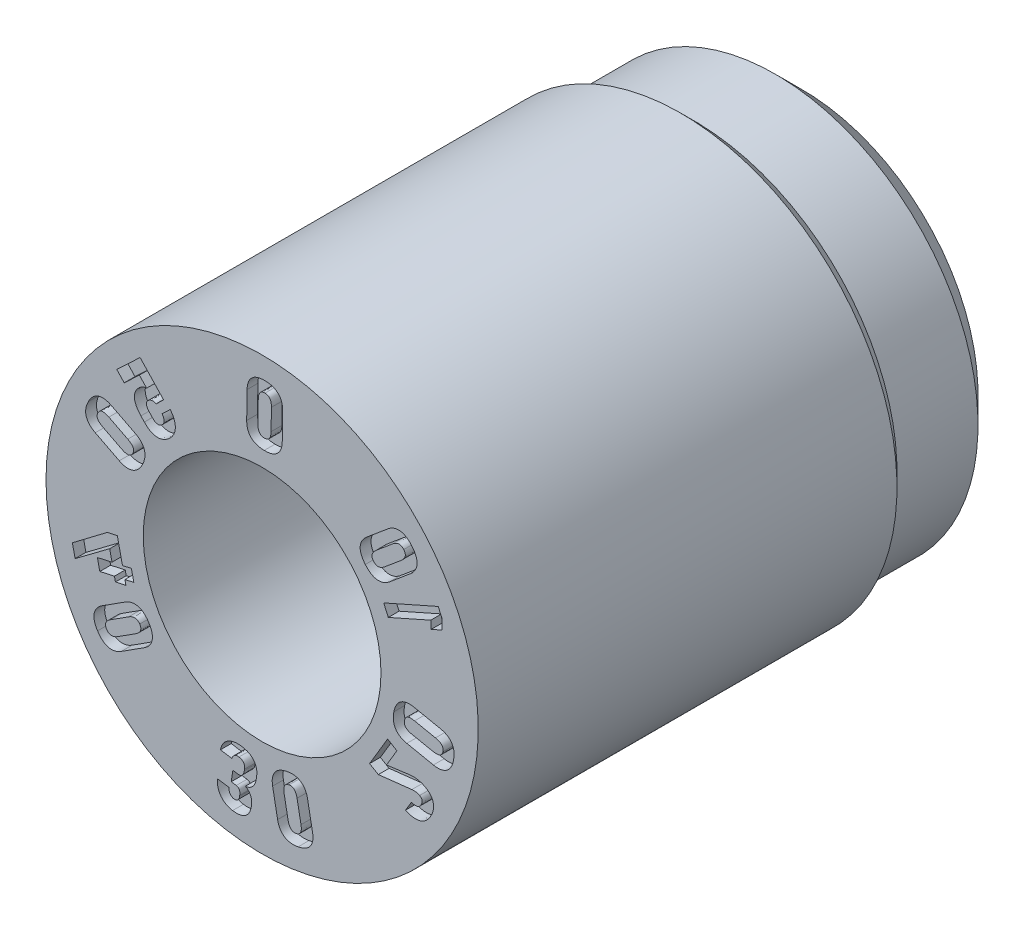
SolidWorks part; units mm, degrees
ref_plane "Front Plane" through (0, 0, 0) normal (0, 0, 1) x (1, 0, 0)
ref_plane "Top Plane" through (0, 0, 0) normal (0, 1, 0) x (1, 0, 0)
ref_plane "Right Plane" through (0, 0, 0) normal (1, 0, 0) x (0, 0, -1)
sketch "Sketch2" plane through (0, 0, 0) normal (0, 1, 0) x (1, 0, 0)
  line L0 (0, 4.8491) -> (0, -49995.1509) construction
  line L10 (3.2496, 10) -> (1.15, 10)
  line L11 (3.75, 9.4996) -> (3.2496, 10)
  line L12 (3.75, 8) -> (3.75, 9.4996)
  line L13 (4, 7.75) -> (3.75, 8)
  line L14 (4, 0) -> (4, 7.75)
  line L15 (2.2, 0) -> (4, 0)
  line L16 (2.2, 0) -> (2.2, 7.468)
  line L17 (1.15, 7.468) -> (2.2, 7.468)
  line L18 (1.15, 7.468) -> (1.15, 10)
  dimension "D1" = 8
  dimension "D2" = 4.4
  dimension "D3" = 2.532
  dimension "D4" = 2.3
  dimension "D5" = 7.5
  dimension "D6" = 10
  dimension "D7" = 45
  dimension "D8" = 45
  dimension "D9" = 2
  dimension "D10" = 0.5004
revolve "Revolve1" add sketch "Sketch2" angle 360 about L0
sketch "Sketch7" plane through (0, 0, 0) normal (0, 0, 1) x (1, 0, 0)
  line L0 (0.3725, 2.7961) -> (0.38, 3.2963)
  line L1 (-0.2782, 3.3062) -> (-0.2857, 2.806)
  line L2 (-0.0776, 2.8562) -> (-0.0715, 3.2502)
  line L3 (0.1719, 3.2466) -> (0.1659, 2.8525)
  line L4 (2.3612, 1.5443) -> (2.7454, 1.8659)
  line L5 (2.3221, 2.3715) -> (1.938, 2.0499)
  line L6 (2.1121, 1.9248) -> (2.4147, 2.1781)
  line L7 (2.5713, 1.991) -> (2.2686, 1.7376)
  line L8 (2.2508, 1.1502) -> (2.3351, 0.96)
  line L9 (2.3351, 0.96) -> (3.1205, 1.3086)
  line L10 (3.1205, 1.3086) -> (3.1287, 1.1654)
  line L11 (3.1287, 1.1654) -> (3.3306, 1.2549)
  line L12 (3.3306, 1.2549) -> (3.3315, 1.4356)
  line L13 (3.3315, 1.4356) -> (3.2595, 1.5981)
  line L14 (3.2595, 1.5981) -> (2.2508, 1.1502)
  line L15 (2.6785, -0.8868) -> (3.1694, -0.9878)
  line L16 (3.3021, -0.3418) -> (2.8112, -0.2408)
  line L17 (2.8212, -0.4551) -> (3.2082, -0.5344)
  line L18 (3.159, -0.7736) -> (2.7721, -0.6942)
  line L19 (2.1503, -1.6515) -> (2.7714, -1.5807)
  line L20 (2.9143, -1.6033) -> (2.9158, -1.604)
  line L21 (2.7652, -1.7854) -> (2.7644, -1.7851)
  line L22 (2.7644, -1.7851) -> (2.6555, -1.9681)
  line L23 (2.6555, -1.9681) -> (2.6562, -1.9685)
  line L24 (3.0303, -1.4233) -> (3.0296, -1.4229)
  line L25 (2.7357, -1.3635) -> (2.3021, -1.4215)
  line L26 (2.3021, -1.4215) -> (2.4949, -1.0975)
  line L27 (2.4949, -1.0975) -> (2.3229, -0.995)
  line L28 (2.3229, -0.995) -> (1.9893, -1.5555)
  line L29 (1.9893, -1.5555) -> (2.1503, -1.6515)
  line L30 (0.1945, -2.814) -> (0.2866, -3.3051)
  line L31 (0.9327, -3.1837) -> (0.8406, -2.6926)
  line L32 (0.6468, -2.783) -> (0.7195, -3.17)
  line L33 (0.4802, -3.2148) -> (0.4075, -2.8278)
  line L34 (-0.7721, -2.7159) -> (-0.56, -2.748)
  line L35 (-0.3261, -2.8028) -> (-0.3298, -2.8283)
  line L36 (-0.4492, -2.943) -> (-0.5414, -2.929)
  line L37 (-0.5414, -2.929) -> (-0.5714, -3.1268)
  line L38 (-0.5714, -3.1268) -> (-0.4793, -3.1408)
  line L39 (-0.4147, -3.2657) -> (-0.4175, -3.2843)
  line L40 (-0.617, -3.238) -> (-0.8284, -3.2058)
  line L41 (-0.2001, -3.3388) -> (-0.1952, -3.3058)
  line L42 (-0.1071, -2.846) -> (-0.102, -2.8131)
  line L43 (-2.5384, -1.2307) -> (-2.9598, -1.5002)
  line L44 (-2.605, -2.0546) -> (-2.1836, -1.785)
  line L45 (-2.3399, -1.639) -> (-2.6718, -1.8513)
  line L46 (-2.8032, -1.6462) -> (-2.4713, -1.4338)
  line L47 (-2.8657, -0.2778) -> (-3.5118, -0.7674)
  line L48 (-3.5118, -0.7674) -> (-3.4613, -0.9955)
  line L49 (-3.4613, -0.9955) -> (-2.8217, -0.5168)
  line L50 (-2.8217, -0.5168) -> (-2.7784, -0.7117)
  line L51 (-2.7149, -0.9971) -> (-2.5208, -0.9538)
  line L52 (-2.5208, -0.9538) -> (-2.5394, -0.8701)
  line L53 (-2.6803, -0.2366) -> (-2.8657, -0.2778)
  line L54 (-3.0489, -0.7718) -> (-3.0041, -0.9734)
  line L55 (-3.0041, -0.9734) -> (-2.7335, -0.9132)
  line L56 (-2.3745, -0.8334) -> (-2.4193, -0.6319)
  line L57 (-2.4193, -0.6319) -> (-2.5842, -0.6685)
  line L58 (-2.3451, 1.5666) -> (-2.7894, 1.7935)
  line L59 (-3.088, 1.2087) -> (-2.6437, 0.9818)
  line L60 (-2.5967, 1.19) -> (-2.9469, 1.3689)
  line L61 (-2.8364, 1.5853) -> (-2.4862, 1.4064)
  line L62 (-1.701, 2.2738) -> (-1.7014, 2.274)
  line L63 (-1.7014, 2.274) -> (-1.8529, 2.1312)
  line L64 (-1.8529, 2.1312) -> (-1.8525, 2.1309)
  line L65 (-2.028, 1.9767) -> (-2.0916, 2.0442)
  line L66 (-1.9637, 2.2332) -> (-1.8219, 2.3667)
  line L67 (-1.8219, 2.3667) -> (-2.2581, 2.8293)
  line L68 (-2.2581, 2.8293) -> (-2.6904, 2.4218)
  line L69 (-2.6904, 2.4218) -> (-2.5526, 2.2758)
  line L70 (-2.5526, 2.2758) -> (-2.2718, 2.5404)
  line L71 (-2.2718, 2.5404) -> (-2.1376, 2.3979)
  line L72 (-2.2435, 1.9012) -> (-2.1799, 1.8336)
  line L73 (-2.7784, -0.7117) -> (-3.0489, -0.7718)
  line L74 (-2.5394, -0.8701) -> (-2.3745, -0.8334)
  line L75 (-2.7335, -0.9132) -> (-2.7149, -0.9971)
  line L76 (-2.5842, -0.6685) -> (-2.6803, -0.2366)
  arc A0 (-0.3895, 2.5068) -> (-1.1202, 2.2762) centre (0, 0) cw construction
  circle A54 centre (0, 0) radius 4 construction
  spline S0 degree 3 poles (0.0388, 2.4886) (0.0641, 2.4882) (0.1012, 2.4896) (0.1485, 2.4981) (0.1806, 2.5064) (0.2105, 2.5176) (0.238, 2.5316) (0.2629, 2.5483) (0.2856, 2.5673) (0.3056, 2.5888) (0.323, 2.6125) (0.3381, 2.6381) (0.35, 2.666) (0.3597, 2.6956) (0.3692, 2.739) (0.3724, 2.7729) (0.3725, 2.7961) knots 0 0 0 0 0.147245 0.214634 0.278461 0.339934 0.399349 0.456893 0.514035 0.570601 0.627042 0.68431 0.742718 0.802848 0.865131 1 1 1 1
  spline S1 degree 3 poles (0.38, 3.2963) (0.3804, 3.3197) (0.3788, 3.3541) (0.3702, 3.3981) (0.3617, 3.4283) (0.3501, 3.4564) (0.336, 3.4825) (0.3191, 3.5064) (0.2996, 3.5284) (0.2774, 3.548) (0.2529, 3.5652) (0.2259, 3.5799) (0.1964, 3.5915) (0.1646, 3.6012) (0.1176, 3.6104) (0.0808, 3.6135) (0.0556, 3.6137) knots 0 0 0 0 0.135917 0.199021 0.259618 0.318029 0.374761 0.431119 0.48785 0.5448 0.602395 0.66114 0.722587 0.786314 0.853593 1 1 1 1
  spline S2 degree 3 poles (0.0556, 3.6137) (0.0302, 3.6142) (-0.0068, 3.6125) (-0.0541, 3.6045) (-0.0862, 3.596) (-0.1161, 3.5852) (-0.1434, 3.5712) (-0.1685, 3.555) (-0.1909, 3.536) (-0.2109, 3.5148) (-0.2287, 3.4915) (-0.2433, 3.4656) (-0.2557, 3.4379) (-0.2653, 3.4079) (-0.2748, 3.3641) (-0.2781, 3.3297) (-0.2782, 3.3062) knots 0 0 0 0 0.147072 0.214294 0.278046 0.339282 0.39804 0.45562 0.512083 0.568257 0.624525 0.681521 0.740022 0.800497 0.863559 1 1 1 1
  spline S3 degree 3 poles (-0.2857, 2.806) (-0.2861, 2.7826) (-0.2844, 2.7482) (-0.2759, 2.7043) (-0.2672, 2.6741) (-0.2557, 2.646) (-0.2415, 2.6199) (-0.2245, 2.5958) (-0.205, 2.5739) (-0.1828, 2.5543) (-0.1583, 2.5371) (-0.1314, 2.5225) (-0.1019, 2.5107) (-0.0702, 2.5012) (-0.0232, 2.4918) (0.0135, 2.4889) (0.0388, 2.4886) knots 0 0 0 0 0.135949 0.199067 0.259266 0.317691 0.375029 0.4314 0.488146 0.545109 0.602717 0.661476 0.722531 0.786691 0.853559 1 1 1 1
  spline S4 degree 3 poles (0.0418, 2.6883) (0.032, 2.6885) (0.0176, 2.6898) (-0.0004, 2.6948) (-0.0125, 2.6995) (-0.0236, 2.7058) (-0.0334, 2.7135) (-0.0422, 2.7224) (-0.0528, 2.7363) (-0.0633, 2.7572) (-0.0761, 2.7982) (-0.0776, 2.8325) (-0.0776, 2.8562) knots 0 0 0 0 0.125784 0.18284 0.238805 0.29185 0.345213 0.397973 0.452338 0.567512 0.695138 1 1 1 1
  spline S5 degree 3 poles (-0.0715, 3.2502) (-0.0714, 3.274) (-0.068, 3.308) (-0.0547, 3.3487) (-0.0433, 3.3691) (-0.0325, 3.3826) (-0.0235, 3.3914) (-0.0132, 3.3985) (-0.0021, 3.4045) (0.0102, 3.4088) (0.0283, 3.4133) (0.0428, 3.4141) (0.0526, 3.414) knots 0 0 0 0 0.305304 0.432513 0.547303 0.601307 0.654799 0.707463 0.761501 0.816088 0.873698 1 1 1 1
  spline S6 degree 3 poles (0.0526, 3.414) (0.0624, 3.4138) (0.0768, 3.4125) (0.0948, 3.4075) (0.1071, 3.4031) (0.1178, 3.3964) (0.1279, 3.389) (0.1368, 3.3801) (0.1474, 3.3662) (0.1579, 3.3454) (0.1703, 3.3044) (0.1721, 3.2703) (0.1719, 3.2466) knots 0 0 0 0 0.125899 0.183939 0.238731 0.29228 0.345132 0.398638 0.453053 0.568333 0.694858 1 1 1 1
  spline S7 degree 3 poles (0.1659, 2.8525) (0.1659, 2.8287) (0.1622, 2.7948) (0.1492, 2.754) (0.1381, 2.7334) (0.1268, 2.72) (0.1179, 2.7111) (0.1075, 2.704) (0.0964, 2.698) (0.0842, 2.6934) (0.066, 2.6891) (0.0516, 2.6882) (0.0418, 2.6883) knots 0 0 0 0 0.304843 0.431582 0.547045 0.60155 0.654961 0.707545 0.761502 0.816365 0.873889 1 1 1 1
  spline S8 degree 3 poles (1.9096, 1.5963) (1.9258, 1.5768) (1.9512, 1.5498) (1.9884, 1.5193) (2.0157, 1.5003) (2.0438, 1.4852) (2.0722, 1.4734) (2.1012, 1.4651) (2.1305, 1.4606) (2.1599, 1.4593) (2.1893, 1.4618) (2.2186, 1.4672) (2.2476, 1.476) (2.2765, 1.4881) (2.3157, 1.5091) (2.3434, 1.5293) (2.3612, 1.5443) knots 0 0 0 0 0.146754 0.214223 0.278378 0.339457 0.398831 0.456272 0.513451 0.570287 0.626693 0.684121 0.742418 0.802239 0.865139 1 1 1 1
  spline S9 degree 3 poles (2.7454, 1.8659) (2.7634, 1.8809) (2.7884, 1.9046) (2.8161, 1.9398) (2.8332, 1.9661) (2.847, 1.9932) (2.8577, 2.0209) (2.8645, 2.0495) (2.8684, 2.0787) (2.869, 2.1083) (2.8658, 2.1382) (2.8593, 2.1683) (2.849, 2.1984) (2.8355, 2.2287) (2.8119, 2.2704) (2.7901, 2.3001) (2.7738, 2.3195) knots 0 0 0 0 0.136048 0.198822 0.259389 0.317756 0.374584 0.430993 0.487788 0.54482 0.602526 0.661561 0.72281 0.786716 0.853482 1 1 1 1
  spline S10 degree 3 poles (2.7738, 2.3195) (2.7575, 2.339) (2.732, 2.366) (2.695, 2.3967) (2.6677, 2.4157) (2.6396, 2.4307) (2.6114, 2.4429) (2.5825, 2.4509) (2.5535, 2.4558) (2.5242, 2.4571) (2.4949, 2.4551) (2.4658, 2.4494) (2.4367, 2.4407) (2.4077, 2.4283) (2.368, 2.4072) (2.3403, 2.3864) (2.3221, 2.3715) knots 0 0 0 0 0.147181 0.214193 0.278272 0.339279 0.398254 0.455627 0.512298 0.56858 0.624812 0.681768 0.739996 0.800344 0.863778 1 1 1 1
  spline S11 degree 3 poles (1.938, 2.0499) (1.92, 2.0348) (1.8949, 2.0111) (1.8673, 1.9759) (1.8501, 1.9496) (1.8362, 1.9225) (1.8257, 1.8946) (1.8185, 1.8661) (1.8147, 1.8369) (1.814, 1.8073) (1.8174, 1.7775) (1.8238, 1.7475) (1.8341, 1.7174) (1.8476, 1.687) (1.8716, 1.6455) (1.8932, 1.6155) (1.9096, 1.5963) knots 0 0 0 0 0.136006 0.198759 0.259307 0.317656 0.374892 0.431311 0.488089 0.545103 0.602375 0.661391 0.722621 0.786507 0.853528 1 1 1 1
  spline S12 degree 3 poles (2.0631, 1.7247) (2.0569, 1.7323) (2.0485, 1.744) (2.0401, 1.7608) (2.0359, 1.7732) (2.0336, 1.7857) (2.0325, 1.7982) (2.0334, 1.8108) (2.0372, 1.8278) (2.0461, 1.8495) (2.0693, 1.8857) (2.0939, 1.9094) (2.1121, 1.9248) knots 0 0 0 0 0.125671 0.183715 0.239256 0.292441 0.345696 0.398512 0.452959 0.567911 0.695546 1 1 1 1
  spline S13 degree 3 poles (2.4147, 2.1781) (2.4332, 2.193) (2.4606, 2.2134) (2.5004, 2.2298) (2.5274, 2.2355) (2.5534, 2.2348) (2.5876, 2.2239) (2.6086, 2.2053) (2.6204, 2.191) knots 0 0 0 0 0.304434 0.431917 0.546865 0.65494 0.760865 1 1 1 1
  spline S14 degree 3 poles (2.6204, 2.191) (2.6266, 2.1833) (2.6352, 2.1718) (2.6432, 2.1548) (2.6474, 2.1425) (2.6498, 2.13) (2.6505, 2.1176) (2.6497, 2.105) (2.6459, 2.088) (2.637, 2.0664) (2.6142, 2.0299) (2.5893, 2.0064) (2.5713, 1.991) knots 0 0 0 0 0.125815 0.183365 0.238969 0.292216 0.3453 0.398176 0.452686 0.56777 0.695197 1 1 1 1
  spline S15 degree 3 poles (2.2686, 1.7376) (2.2502, 1.7228) (2.2227, 1.7022) (2.1828, 1.6861) (2.1558, 1.6804) (2.1298, 1.6809) (2.0959, 1.6923) (2.0748, 1.7103) (2.0631, 1.7247) knots 0 0 0 0 0.304817 0.43327 0.548363 0.655627 0.761811 1 1 1 1
  spline S16 degree 3 poles (2.4382, -0.5008) (2.4332, -0.5257) (2.4278, -0.5624) (2.427, -0.6106) (2.4291, -0.6439) (2.435, -0.6752) (2.4431, -0.7049) (2.455, -0.7325) (2.4695, -0.7584) (2.4869, -0.7822) (2.507, -0.8039) (2.5295, -0.8232) (2.5544, -0.8406) (2.582, -0.8555) (2.6229, -0.8729) (2.6558, -0.8821) (2.6785, -0.8868) knots 0 0 0 0 0.147061 0.214442 0.278734 0.33998 0.399082 0.456654 0.51381 0.570691 0.627096 0.684335 0.742673 0.80269 0.865473 1 1 1 1
  spline S17 degree 3 poles (3.1694, -0.9878) (3.1924, -0.9925) (3.2265, -0.9974) (3.2714, -0.997) (3.3027, -0.9943) (3.3325, -0.988) (3.3608, -0.979) (3.3877, -0.9669) (3.4128, -0.9517) (3.4361, -0.9336) (3.4576, -0.9128) (3.4771, -0.8891) (3.4943, -0.8623) (3.5097, -0.8328) (3.5275, -0.7882) (3.5372, -0.7525) (3.5424, -0.7278) knots 0 0 0 0 0.136056 0.198873 0.25951 0.31764 0.375024 0.431404 0.487871 0.544848 0.602094 0.661145 0.722212 0.78603 0.853579 1 1 1 1
  spline S18 degree 3 poles (3.5424, -0.7278) (3.5472, -0.7029) (3.553, -0.6662) (3.5538, -0.6182) (3.5515, -0.5849) (3.5461, -0.5536) (3.5381, -0.5239) (3.5266, -0.4962) (3.5122, -0.4704) (3.495, -0.4467) (3.4751, -0.4251) (3.4526, -0.4057) (3.4277, -0.3883) (3.3999, -0.3734) (3.3586, -0.3558) (3.3252, -0.3464) (3.3021, -0.3418) knots 0 0 0 0 0.14674 0.214034 0.277859 0.33915 0.397904 0.455392 0.512131 0.568567 0.624504 0.681669 0.739931 0.8003 0.863434 1 1 1 1
  spline S19 degree 3 poles (2.8112, -0.2408) (2.7882, -0.236) (2.7541, -0.2312) (2.7092, -0.2315) (2.6779, -0.2343) (2.648, -0.2403) (2.6198, -0.2496) (2.5929, -0.2617) (2.5676, -0.2767) (2.5442, -0.2949) (2.5227, -0.3158) (2.5034, -0.3398) (2.4862, -0.3665) (2.4709, -0.3959) (2.453, -0.4404) (2.4433, -0.4761) (2.4382, -0.5008) knots 0 0 0 0 0.136038 0.198846 0.259475 0.317953 0.375003 0.431375 0.488088 0.545057 0.602695 0.661619 0.722678 0.786488 0.853595 1 1 1 1
  spline S20 degree 3 poles (2.6343, -0.5412) (2.6362, -0.5316) (2.6401, -0.5176) (2.6484, -0.5009) (2.6552, -0.4897) (2.6636, -0.4802) (2.6729, -0.4718) (2.6831, -0.4645) (2.6988, -0.4568) (2.7213, -0.45) (2.7642, -0.4463) (2.798, -0.4501) (2.8212, -0.4551) knots 0 0 0 0 0.126091 0.183467 0.23858 0.29265 0.345213 0.397959 0.452865 0.568062 0.695892 1 1 1 1
  spline S21 degree 3 poles (3.2082, -0.5344) (3.2316, -0.5391) (3.2642, -0.5488) (3.302, -0.5694) (3.3202, -0.5842) (3.3313, -0.5977) (3.3382, -0.6082) (3.3434, -0.6197) (3.3474, -0.6318) (3.3492, -0.6448) (3.3505, -0.6634) (3.3482, -0.6778) (3.3465, -0.6874) knots 0 0 0 0 0.304553 0.431243 0.546887 0.601523 0.654465 0.707175 0.761317 0.816658 0.87428 1 1 1 1
  spline S22 degree 3 poles (3.3465, -0.6874) (3.3448, -0.6971) (3.3404, -0.7109) (3.3322, -0.7277) (3.3254, -0.7388) (3.317, -0.7484) (3.3077, -0.7569) (3.2973, -0.7639) (3.2816, -0.7717) (3.2591, -0.7784) (3.2163, -0.7828) (3.1824, -0.7783) (3.159, -0.7736) knots 0 0 0 0 0.125915 0.183235 0.238294 0.29231 0.344823 0.398024 0.452876 0.56796 0.6953 1 1 1 1
  spline S23 degree 3 poles (2.7721, -0.6942) (2.7488, -0.6895) (2.7159, -0.6801) (2.6785, -0.659) (2.6602, -0.6443) (2.649, -0.6308) (2.6422, -0.6203) (2.6369, -0.6089) (2.6333, -0.5967) (2.6313, -0.5839) (2.6306, -0.5652) (2.632, -0.5508) (2.6343, -0.5412) knots 0 0 0 0 0.30481 0.431712 0.547453 0.602135 0.655122 0.707877 0.761446 0.816833 0.874083 1 1 1 1
  spline S24 degree 3 poles (2.7714, -1.5807) (2.7976, -1.578) (2.8309, -1.5771) (2.8686, -1.585) (2.8903, -1.591) (2.9051, -1.5981) (2.9143, -1.6033) knots 0 0 0 0 0.541423 0.666876 0.784327 1 1 1 1
  spline S25 degree 3 poles (2.9158, -1.604) (2.9272, -1.611) (2.9429, -1.6235) (2.9559, -1.646) (2.9609, -1.664) (2.9617, -1.6835) (2.9572, -1.7125) (2.9471, -1.7333) (2.939, -1.7469) knots 0 0 0 0 0.245918 0.356468 0.468349 0.584908 0.709615 1 1 1 1
  spline S26 degree 3 poles (2.939, -1.7469) (2.931, -1.7607) (2.9156, -1.7787) (2.8892, -1.7951) (2.8673, -1.8019) (2.8436, -1.8051) (2.8084, -1.802) (2.7823, -1.7934) (2.7652, -1.7854) knots 0 0 0 0 0.240841 0.353252 0.467359 0.586555 0.713016 1 1 1 1
  spline S27 degree 3 poles (2.6562, -1.9685) (2.685, -1.9836) (2.7295, -2.0008) (2.7901, -2.0142) (2.8336, -2.0174) (2.8757, -2.0154) (2.9163, -2.0081) (2.9549, -1.9949) (2.9914, -1.976) (3.0256, -1.9522) (3.0685, -1.9127) (3.0948, -1.8765) (3.1104, -1.8507) knots 0 0 0 0 0.185651 0.271495 0.354398 0.434528 0.512277 0.589458 0.667295 0.746479 0.827159 1 1 1 1
  spline S28 degree 3 poles (3.1104, -1.8507) (3.1268, -1.8231) (3.1478, -1.7811) (3.1651, -1.7232) (3.1725, -1.6825) (3.1742, -1.6431) (3.1699, -1.6053) (3.1603, -1.5692) (3.1451, -1.535) (3.1244, -1.5029) (3.0881, -1.4627) (3.0546, -1.4378) (3.0303, -1.4233) knots 0 0 0 0 0.195291 0.283253 0.366637 0.445822 0.522204 0.596866 0.672009 0.748509 0.827798 1 1 1 1
  spline S29 degree 3 poles (3.0296, -1.4229) (3.008, -1.4101) (2.9739, -1.3936) (2.9257, -1.3776) (2.8883, -1.3683) (2.85, -1.3625) (2.799, -1.3585) (2.7608, -1.3601) (2.7357, -1.3635) knots 0 0 0 0 0.246411 0.371095 0.497941 0.625272 0.751146 1 1 1 1
  spline S30 degree 3 poles (0.4599, -2.4466) (0.435, -2.4511) (0.399, -2.4603) (0.3542, -2.4777) (0.3244, -2.4923) (0.2976, -2.5093) (0.2735, -2.5284) (0.2522, -2.5494) (0.234, -2.5728) (0.2187, -2.5978) (0.2064, -2.6245) (0.1966, -2.6524) (0.1905, -2.682) (0.1867, -2.713) (0.1862, -2.7574) (0.1901, -2.7913) (0.1945, -2.814) knots 0 0 0 0 0.14708 0.214839 0.278938 0.340014 0.399093 0.456868 0.513928 0.570655 0.627181 0.684187 0.742494 0.802536 0.865451 1 1 1 1
  spline S31 degree 3 poles (0.2866, -3.3051) (0.2909, -3.3281) (0.2995, -3.3613) (0.3162, -3.4028) (0.3309, -3.4305) (0.3477, -3.4557) (0.3666, -3.4784) (0.3879, -3.4986) (0.4114, -3.5162) (0.437, -3.531) (0.4644, -3.5428) (0.4936, -3.5518) (0.5248, -3.5577) (0.5579, -3.5607) (0.6058, -3.5603) (0.6424, -3.5557) (0.6671, -3.5511) knots 0 0 0 0 0.135991 0.198957 0.259278 0.317536 0.374793 0.430928 0.487677 0.544842 0.602257 0.660982 0.722058 0.786137 0.853629 1 1 1 1
  spline S32 degree 3 poles (0.6671, -3.5511) (0.6921, -3.5467) (0.7278, -3.5373) (0.7727, -3.5204) (0.8024, -3.5057) (0.8294, -3.4889) (0.8536, -3.4701) (0.8747, -3.449) (0.8932, -3.4261) (0.9086, -3.4013) (0.921, -3.3748) (0.9308, -3.3469) (0.937, -3.3171) (0.9403, -3.2859) (0.9415, -3.241) (0.9368, -3.2068) (0.9327, -3.1837) knots 0 0 0 0 0.146861 0.214087 0.27809 0.338994 0.397858 0.455548 0.512086 0.568467 0.62461 0.681531 0.739751 0.800471 0.863458 1 1 1 1
  spline S33 degree 3 poles (0.8406, -2.6926) (0.8362, -2.6696) (0.8279, -2.6363) (0.8107, -2.595) (0.7962, -2.5673) (0.7793, -2.5421) (0.7604, -2.5193) (0.7391, -2.4991) (0.7156, -2.4816) (0.69, -2.4667) (0.6625, -2.4549) (0.6332, -2.4461) (0.602, -2.4401) (0.569, -2.4372) (0.5212, -2.4374) (0.4846, -2.442) (0.4599, -2.4466) knots 0 0 0 0 0.135999 0.198976 0.2593 0.317561 0.374821 0.430959 0.487712 0.54488 0.602298 0.661367 0.722447 0.78653 0.853621 1 1 1 1
  spline S34 degree 3 poles (0.4968, -2.6428) (0.5064, -2.6406) (0.5207, -2.6397) (0.5394, -2.6404) (0.5522, -2.643) (0.5643, -2.6467) (0.5755, -2.6523) (0.5861, -2.6591) (0.5989, -2.6708) (0.6137, -2.6889) (0.6334, -2.727) (0.6425, -2.7596) (0.6468, -2.783) knots 0 0 0 0 0.125734 0.183609 0.239155 0.292267 0.345819 0.398715 0.453554 0.568369 0.695746 1 1 1 1
  spline S35 degree 3 poles (0.7195, -3.17) (0.7235, -3.1933) (0.7277, -3.2271) (0.7225, -3.2697) (0.7156, -3.292) (0.7074, -3.3074) (0.7004, -3.3178) (0.6918, -3.327) (0.6818, -3.3348) (0.6709, -3.3419) (0.6539, -3.3497) (0.64, -3.3534) (0.6303, -3.3552) knots 0 0 0 0 0.30425 0.431921 0.546902 0.601209 0.654314 0.707409 0.761607 0.816243 0.873811 1 1 1 1
  spline S36 degree 3 poles (0.6303, -3.3552) (0.6207, -3.3567) (0.6063, -3.3587) (0.5877, -3.3572) (0.5748, -3.3551) (0.5629, -3.3509) (0.5514, -3.3458) (0.5411, -3.3386) (0.5279, -3.3271) (0.5134, -3.3088) (0.4931, -3.2711) (0.4849, -3.2379) (0.4802, -3.2148) knots 0 0 0 0 0.125555 0.183793 0.238793 0.292478 0.345294 0.398936 0.452885 0.568531 0.695937 1 1 1 1
  spline S37 degree 3 poles (0.4075, -2.8278) (0.4031, -2.8045) (0.3993, -2.7707) (0.4046, -2.7282) (0.4114, -2.7059) (0.4196, -2.6906) (0.4267, -2.6802) (0.4353, -2.6711) (0.4451, -2.6631) (0.4561, -2.6561) (0.4731, -2.6483) (0.4871, -2.6445) (0.4968, -2.6428) knots 0 0 0 0 0.304571 0.431493 0.546555 0.600901 0.654042 0.707176 0.760498 0.816113 0.873722 1 1 1 1
  spline S38 degree 3 poles (-0.3767, -2.4638) (-0.408, -2.4591) (-0.4547, -2.456) (-0.5156, -2.4624) (-0.5581, -2.4722) (-0.598, -2.4864) (-0.6347, -2.5058) (-0.6681, -2.53) (-0.6978, -2.559) (-0.7238, -2.592) (-0.753, -2.643) (-0.7661, -2.6861) (-0.7721, -2.7159) knots 0 0 0 0 0.181494 0.266326 0.349485 0.43004 0.508346 0.586249 0.665074 0.745043 0.826062 1 1 1 1
  spline S39 degree 3 poles (-0.56, -2.748) (-0.557, -2.7376) (-0.5513, -2.7228) (-0.5407, -2.7051) (-0.5317, -2.6937) (-0.5217, -2.6838) (-0.5109, -2.6755) (-0.4992, -2.6685) (-0.4865, -2.6634) (-0.4732, -2.6598) (-0.454, -2.6572) (-0.4393, -2.6583) (-0.4294, -2.6597) knots 0 0 0 0 0.186012 0.272116 0.354769 0.434747 0.513253 0.589741 0.6683 0.747519 0.826936 1 1 1 1
  spline S40 degree 3 poles (-0.4294, -2.6597) (-0.4118, -2.6622) (-0.3866, -2.6694) (-0.3589, -2.6883) (-0.3431, -2.7055) (-0.3319, -2.7262) (-0.3223, -2.7586) (-0.3236, -2.7851) (-0.3261, -2.8028) knots 0 0 0 0 0.265927 0.382937 0.49814 0.612757 0.731168 1 1 1 1
  spline S41 degree 3 poles (-0.3298, -2.8283) (-0.3323, -2.847) (-0.3395, -2.8729) (-0.355, -2.9035) (-0.3695, -2.9207) (-0.3863, -2.9338) (-0.4128, -2.9447) (-0.4348, -2.9453) (-0.4492, -2.943) knots 0 0 0 0 0.300063 0.427974 0.545986 0.657554 0.765422 1 1 1 1
  spline S42 degree 3 poles (-0.4793, -3.1408) (-0.4676, -3.1427) (-0.4501, -3.1483) (-0.4325, -3.1645) (-0.4226, -3.1796) (-0.4156, -3.1976) (-0.4108, -3.2266) (-0.4123, -3.2497) (-0.4147, -3.2657) knots 0 0 0 0 0.226395 0.333882 0.446442 0.566064 0.695007 1 1 1 1
  spline S43 degree 3 poles (-0.4175, -3.2843) (-0.4202, -3.2991) (-0.4251, -3.3208) (-0.4397, -3.3448) (-0.4521, -3.3589) (-0.4674, -3.369) (-0.491, -3.3779) (-0.5107, -3.3777) (-0.5235, -3.3757) knots 0 0 0 0 0.287276 0.410871 0.527704 0.640138 0.752803 1 1 1 1
  spline S44 degree 3 poles (-0.5235, -3.3757) (-0.5324, -3.3743) (-0.5454, -3.3705) (-0.5613, -3.3621) (-0.5721, -3.3539) (-0.5821, -3.3443) (-0.5905, -3.3329) (-0.5983, -3.3205) (-0.6043, -3.3063) (-0.6098, -3.2912) (-0.6148, -3.2683) (-0.6168, -3.2504) (-0.617, -3.238) knots 0 0 0 0 0.14849 0.221369 0.295943 0.372134 0.449201 0.529682 0.613648 0.702783 0.795734 1 1 1 1
  spline S45 degree 3 poles (-0.8284, -3.2058) (-0.8304, -3.2377) (-0.8287, -3.2848) (-0.8161, -3.345) (-0.8018, -3.386) (-0.783, -3.4238) (-0.7599, -3.458) (-0.7326, -3.4883) (-0.7015, -3.5147) (-0.6669, -3.5371) (-0.616, -3.5612) (-0.5745, -3.5718) (-0.5462, -3.5762) knots 0 0 0 0 0.185619 0.272301 0.356076 0.437426 0.516807 0.595045 0.673812 0.753113 0.833343 1 1 1 1
  spline S46 degree 3 poles (-0.5462, -3.5762) (-0.5234, -3.5797) (-0.4897, -3.5827) (-0.4458, -3.5815) (-0.4154, -3.5776) (-0.3868, -3.5714) (-0.3597, -3.5626) (-0.3344, -3.5509) (-0.3109, -3.5369) (-0.2893, -3.5202) (-0.27, -3.501) (-0.2526, -3.4797) (-0.2379, -3.4559) (-0.2246, -3.4301) (-0.2107, -3.3911) (-0.2031, -3.3603) (-0.2001, -3.3388) knots 0 0 0 0 0.144887 0.212007 0.275465 0.337082 0.395977 0.454157 0.511361 0.568022 0.624947 0.682058 0.740372 0.800814 0.863818 1 1 1 1
  spline S47 degree 3 poles (-0.1952, -3.3058) (-0.1918, -3.2819) (-0.1903, -3.2458) (-0.2003, -3.1997) (-0.2125, -3.1677) (-0.2297, -3.138) (-0.2594, -3.1013) (-0.2887, -3.0799) (-0.3094, -3.0677) knots 0 0 0 0 0.25747 0.378865 0.499433 0.620408 0.74257 1 1 1 1
  spline S48 degree 3 poles (-0.3094, -3.0677) (-0.2963, -3.0667) (-0.2769, -3.064) (-0.2524, -3.0562) (-0.2351, -3.0489) (-0.2186, -3.0401) (-0.2031, -3.0296) (-0.1885, -3.0174) (-0.1748, -3.0038) (-0.162, -2.9888) (-0.151, -2.9719) (-0.1402, -2.9544) (-0.1314, -2.9351) (-0.1232, -2.9148) (-0.1147, -2.885) (-0.1091, -2.862) (-0.1071, -2.846) knots 0 0 0 0 0.120979 0.178629 0.236062 0.292808 0.3499 0.407924 0.466829 0.527081 0.588702 0.651421 0.715827 0.78253 0.852492 1 1 1 1
  spline S49 degree 3 poles (-0.102, -2.8131) (-0.0977, -2.7834) (-0.0946, -2.7394) (-0.1028, -2.683) (-0.1137, -2.6447) (-0.1297, -2.6093) (-0.1513, -2.5775) (-0.1774, -2.5488) (-0.2087, -2.5241) (-0.2443, -2.5029) (-0.2997, -2.4789) (-0.3452, -2.4686) (-0.3767, -2.4638) knots 0 0 0 0 0.178256 0.259418 0.337555 0.413897 0.489006 0.564948 0.643052 0.724727 0.810858 1 1 1 1
  spline S50 degree 3 poles (-2.0977, -1.3392) (-2.1113, -1.3179) (-2.1332, -1.288) (-2.1662, -1.253) (-2.1909, -1.2307) (-2.2167, -1.212) (-2.2435, -1.197) (-2.2711, -1.185) (-2.2996, -1.177) (-2.3285, -1.1719) (-2.3579, -1.1706) (-2.3875, -1.1724) (-2.4174, -1.1772) (-2.4475, -1.1856) (-2.4888, -1.202) (-2.5189, -1.2181) (-2.5384, -1.2307) knots 0 0 0 0 0.146843 0.214582 0.278521 0.339939 0.399121 0.456836 0.513887 0.570494 0.627118 0.684169 0.742275 0.802589 0.865169 1 1 1 1
  spline S51 degree 3 poles (-2.9598, -1.5002) (-2.9797, -1.5127) (-3.007, -1.5334) (-3.0392, -1.5644) (-3.0595, -1.5883) (-3.0767, -1.6134) (-3.0905, -1.6397) (-3.1015, -1.667) (-3.1088, -1.6954) (-3.1129, -1.7246) (-3.1139, -1.7546) (-3.111, -1.7851) (-3.1045, -1.8162) (-3.0951, -1.848) (-3.0769, -1.8923) (-3.059, -1.9245) (-3.0454, -1.9457) knots 0 0 0 0 0.135987 0.198749 0.259059 0.317543 0.374889 0.431369 0.48779 0.544885 0.60242 0.661504 0.722331 0.786569 0.853785 1 1 1 1
  spline S52 degree 3 poles (-3.0454, -1.9457) (-3.0316, -1.9669) (-3.01, -1.9971) (-2.9771, -2.0321) (-2.9524, -2.0542) (-2.927, -2.0731) (-2.9003, -2.0883) (-2.873, -2.1004) (-2.8447, -2.1086) (-2.816, -2.1139) (-2.7867, -2.1153) (-2.7571, -2.1135) (-2.7271, -2.1086) (-2.6969, -2.1001) (-2.6551, -2.0839) (-2.6248, -2.0673) (-2.605, -2.0546) knots 0 0 0 0 0.146937 0.214226 0.278122 0.339157 0.397904 0.455568 0.512087 0.568544 0.624565 0.681576 0.740245 0.800518 0.863357 1 1 1 1
  spline S53 degree 3 poles (-2.1836, -1.785) (-2.1639, -1.7723) (-2.1361, -1.752) (-2.104, -1.7208) (-2.0836, -1.6969) (-2.0665, -1.6717) (-2.0527, -1.6454) (-2.0416, -1.6182) (-2.0343, -1.5897) (-2.0302, -1.5605) (-2.0292, -1.5305) (-2.0322, -1.5) (-2.0384, -1.4688) (-2.0481, -1.4371) (-2.0662, -1.3928) (-2.0839, -1.3604) (-2.0977, -1.3392) knots 0 0 0 0 0.136055 0.199166 0.259422 0.317854 0.375149 0.431579 0.487949 0.544993 0.602477 0.661509 0.722631 0.786488 0.853645 1 1 1 1
  spline S54 degree 3 poles (-2.266, -1.4469) (-2.2608, -1.4553) (-2.2539, -1.468) (-2.248, -1.4857) (-2.2453, -1.4984) (-2.2445, -1.5111) (-2.2452, -1.5236) (-2.248, -1.5359) (-2.2536, -1.5524) (-2.2651, -1.5728) (-2.2924, -1.6059) (-2.3201, -1.6259) (-2.3399, -1.639) knots 0 0 0 0 0.126219 0.183744 0.238457 0.291969 0.345259 0.398169 0.45299 0.568024 0.695385 1 1 1 1
  spline S55 degree 3 poles (-2.6718, -1.8513) (-2.6919, -1.8641) (-2.7219, -1.8804) (-2.7634, -1.8917) (-2.7909, -1.8939) (-2.8165, -1.8897) (-2.8489, -1.8748) (-2.8669, -1.8532) (-2.8771, -1.838) knots 0 0 0 0 0.305077 0.432928 0.548608 0.655668 0.761936 1 1 1 1
  spline S56 degree 3 poles (-2.8771, -1.838) (-2.8823, -1.8296) (-2.8892, -1.8169) (-2.895, -1.7992) (-2.8977, -1.7865) (-2.8986, -1.7739) (-2.8978, -1.7614) (-2.8953, -1.7491) (-2.8897, -1.7326) (-2.8779, -1.7124) (-2.8508, -1.6792) (-2.823, -1.6592) (-2.8032, -1.6462) knots 0 0 0 0 0.126304 0.183867 0.238616 0.292164 0.345489 0.398651 0.452557 0.567735 0.695181 1 1 1 1
  spline S57 degree 3 poles (-2.4713, -1.4338) (-2.4512, -1.4211) (-2.4212, -1.4048) (-2.3798, -1.3935) (-2.3524, -1.3912) (-2.3267, -1.3951) (-2.2942, -1.4102) (-2.2761, -1.4317) (-2.266, -1.4469) knots 0 0 0 0 0.304964 0.432768 0.547567 0.654838 0.762025 1 1 1 1
  spline S58 degree 3 poles (-2.2166, 1.1326) (-2.2051, 1.1551) (-2.1904, 1.189) (-2.1768, 1.235) (-2.1702, 1.2676) (-2.1672, 1.2992) (-2.1677, 1.3298) (-2.1712, 1.3595) (-2.1784, 1.3882) (-2.189, 1.4155) (-2.2022, 1.4416) (-2.2187, 1.4662) (-2.2383, 1.4892) (-2.2605, 1.511) (-2.2952, 1.5387) (-2.3245, 1.5561) (-2.3451, 1.5666) knots 0 0 0 0 0.147164 0.214748 0.278753 0.340074 0.399069 0.45668 0.513852 0.570603 0.62694 0.683948 0.742381 0.802361 0.865024 1 1 1 1
  spline S59 degree 3 poles (-2.7894, 1.7935) (-2.8102, 1.8043) (-2.8419, 1.8175) (-2.8848, 1.8296) (-2.9157, 1.835) (-2.9459, 1.8372) (-2.9754, 1.8357) (-3.0044, 1.8313) (-3.0326, 1.8237) (-3.0599, 1.8124) (-3.0862, 1.7981) (-3.1111, 1.7802) (-3.1347, 1.759) (-3.1573, 1.7349) (-3.1861, 1.6968) (-3.2053, 1.6654) (-3.2164, 1.6427) knots 0 0 0 0 0.136066 0.198849 0.259396 0.317712 0.374849 0.431022 0.487687 0.544502 0.602343 0.661451 0.722598 0.786353 0.853457 1 1 1 1
  spline S60 degree 3 poles (-3.2164, 1.6427) (-3.2278, 1.6202) (-3.2429, 1.5864) (-3.2565, 1.5405) (-3.263, 1.5079) (-3.2663, 1.4764) (-3.2662, 1.4459) (-3.2628, 1.4163) (-3.2556, 1.3878) (-3.2455, 1.3604) (-3.2322, 1.3344) (-3.2157, 1.3099) (-3.1964, 1.2865) (-3.1734, 1.265) (-3.1388, 1.2366) (-3.1087, 1.2195) (-3.088, 1.2087) knots 0 0 0 0 0.146714 0.214199 0.278112 0.339306 0.398113 0.455261 0.511947 0.568312 0.624567 0.681492 0.739809 0.80028 0.86369 1 1 1 1
  spline S61 degree 3 poles (-2.6437, 0.9818) (-2.6229, 0.971) (-2.5912, 0.9578) (-2.5483, 0.9457) (-2.5174, 0.9402) (-2.4871, 0.9383) (-2.4575, 0.9395) (-2.4286, 0.9442) (-2.4003, 0.9518) (-2.3731, 0.9631) (-2.3468, 0.9772) (-2.322, 0.9951) (-2.2984, 1.0163) (-2.2757, 1.0404) (-2.247, 1.0785) (-2.2278, 1.11) (-2.2166, 1.1326) knots 0 0 0 0 0.136076 0.198864 0.259415 0.31807 0.374847 0.431411 0.488081 0.5449 0.602314 0.661426 0.722578 0.786338 0.853446 1 1 1 1
  spline S62 degree 3 poles (-2.3942, 1.2231) (-2.3988, 1.2145) (-2.4061, 1.202) (-2.4185, 1.1881) (-2.428, 1.1793) (-2.4386, 1.1723) (-2.4497, 1.1667) (-2.4616, 1.1625) (-2.4787, 1.1595) (-2.502, 1.1591) (-2.5443, 1.1658) (-2.5755, 1.1797) (-2.5967, 1.19) knots 0 0 0 0 0.126192 0.18319 0.239104 0.291879 0.345321 0.398409 0.452459 0.567629 0.695784 1 1 1 1
  spline S63 degree 3 poles (-2.9469, 1.3689) (-2.9678, 1.3799) (-2.9974, 1.397) (-3.0276, 1.4274) (-3.0411, 1.4464) (-3.0484, 1.4621) (-3.0521, 1.4741) (-3.0539, 1.4864) (-3.0545, 1.499) (-3.0529, 1.5119) (-3.0489, 1.5302) (-3.0435, 1.5435) (-3.0389, 1.5522) knots 0 0 0 0 0.304981 0.432052 0.547155 0.601879 0.654644 0.707392 0.760582 0.816248 0.873981 1 1 1 1
  spline S64 degree 3 poles (-3.0389, 1.5522) (-3.0343, 1.5609) (-3.027, 1.5733) (-3.0147, 1.5872) (-3.0051, 1.5959) (-2.9946, 1.603) (-2.9834, 1.6086) (-2.9715, 1.6128) (-2.9544, 1.6158) (-2.9312, 1.6163) (-2.8889, 1.6091) (-2.8575, 1.596) (-2.8364, 1.5853) knots 0 0 0 0 0.126206 0.183209 0.238175 0.291915 0.345362 0.398456 0.452511 0.567694 0.695183 1 1 1 1
  spline S65 degree 3 poles (-2.4862, 1.4064) (-2.4651, 1.3957) (-2.4361, 1.378) (-2.4055, 1.348) (-2.392, 1.3289) (-2.3846, 1.3132) (-2.381, 1.3012) (-2.3791, 1.2889) (-2.3787, 1.2762) (-2.3802, 1.2633) (-2.3842, 1.2452) (-2.3896, 1.2318) (-2.3942, 1.2231) knots 0 0 0 0 0.304741 0.431981 0.547103 0.601836 0.65461 0.707366 0.761897 0.816217 0.87396 1 1 1 1
  spline S66 degree 3 poles (-1.7097, 1.8106) (-1.689, 1.83) (-1.6613, 1.8622) (-1.6343, 1.9109) (-1.6192, 1.9486) (-1.6093, 1.9879) (-1.6054, 2.0283) (-1.6071, 2.0694) (-1.6144, 2.1111) (-1.6277, 2.1528) (-1.6529, 2.2097) (-1.6805, 2.2488) (-1.701, 2.2738) knots 0 0 0 0 0.165096 0.244161 0.322863 0.401065 0.478437 0.557873 0.639521 0.724061 0.811674 1 1 1 1
  spline S67 degree 3 poles (-1.8525, 2.1309) (-1.8411, 2.1162) (-1.827, 2.0931) (-1.8165, 2.06) (-1.8139, 2.0365) (-1.8162, 2.0139) (-1.8252, 1.9847) (-1.8399, 1.9664) (-1.8509, 1.9557) knots 0 0 0 0 0.287402 0.412847 0.533159 0.648498 0.761424 1 1 1 1
  spline S68 degree 3 poles (-1.8509, 1.9557) (-1.8628, 1.9444) (-1.8831, 1.9302) (-1.9141, 1.9228) (-1.9372, 1.9228) (-1.9606, 1.9285) (-1.9933, 1.9437) (-2.0145, 1.9628) (-2.028, 1.9767) knots 0 0 0 0 0.244799 0.356012 0.468217 0.585265 0.71027 1 1 1 1
  spline S69 degree 3 poles (-2.0916, 2.0442) (-2.1047, 2.0585) (-2.1225, 2.0803) (-2.137, 2.1129) (-2.1419, 2.1355) (-2.142, 2.1573) (-2.1346, 2.1855) (-2.1214, 2.2036) (-2.1106, 2.2136) knots 0 0 0 0 0.303818 0.432955 0.551312 0.662077 0.770085 1 1 1 1
  spline S70 degree 3 poles (-2.1106, 2.2136) (-2.1003, 2.223) (-2.0836, 2.2359) (-2.0582, 2.2456) (-2.0392, 2.2501) (-2.0199, 2.251) (-1.9938, 2.2475) (-1.9751, 2.2402) (-1.9637, 2.2332) knots 0 0 0 0 0.263935 0.387545 0.508713 0.628584 0.748085 1 1 1 1
  spline S71 degree 3 poles (-2.1376, 2.3979) (-2.1492, 2.398) (-2.1672, 2.3957) (-2.1909, 2.3881) (-2.2097, 2.3804) (-2.2282, 2.3708) (-2.2517, 2.3565) (-2.2677, 2.3437) (-2.2775, 2.3343) knots 0 0 0 0 0.221228 0.343295 0.474928 0.609445 0.74182 1 1 1 1
  spline S72 degree 3 poles (-2.2775, 2.3343) (-2.2971, 2.316) (-2.3227, 2.2857) (-2.3468, 2.24) (-2.3583, 2.205) (-2.3644, 2.169) (-2.3641, 2.1318) (-2.3585, 2.0939) (-2.3464, 2.0555) (-2.3291, 2.0166) (-2.2971, 1.9629) (-2.2663, 1.9254) (-2.2435, 1.9012) knots 0 0 0 0 0.163536 0.239344 0.313332 0.387035 0.461381 0.538615 0.619713 0.705843 0.797385 1 1 1 1
  spline S73 degree 3 poles (-2.1799, 1.8336) (-2.157, 1.8096) (-2.1208, 1.7766) (-2.0668, 1.7438) (-2.027, 1.7259) (-1.9866, 1.7144) (-1.9459, 1.7093) (-1.9052, 1.7101) (-1.8647, 1.7179) (-1.8245, 1.7316) (-1.7701, 1.7594) (-1.733, 1.7885) (-1.7097, 1.8106) knots 0 0 0 0 0.186936 0.272238 0.353274 0.431373 0.50698 0.582264 0.658704 0.737467 0.819917 1 1 1 1
extrude "Cut-Extrude1" cut sketch "Sketch7" against normal blind 0.2
